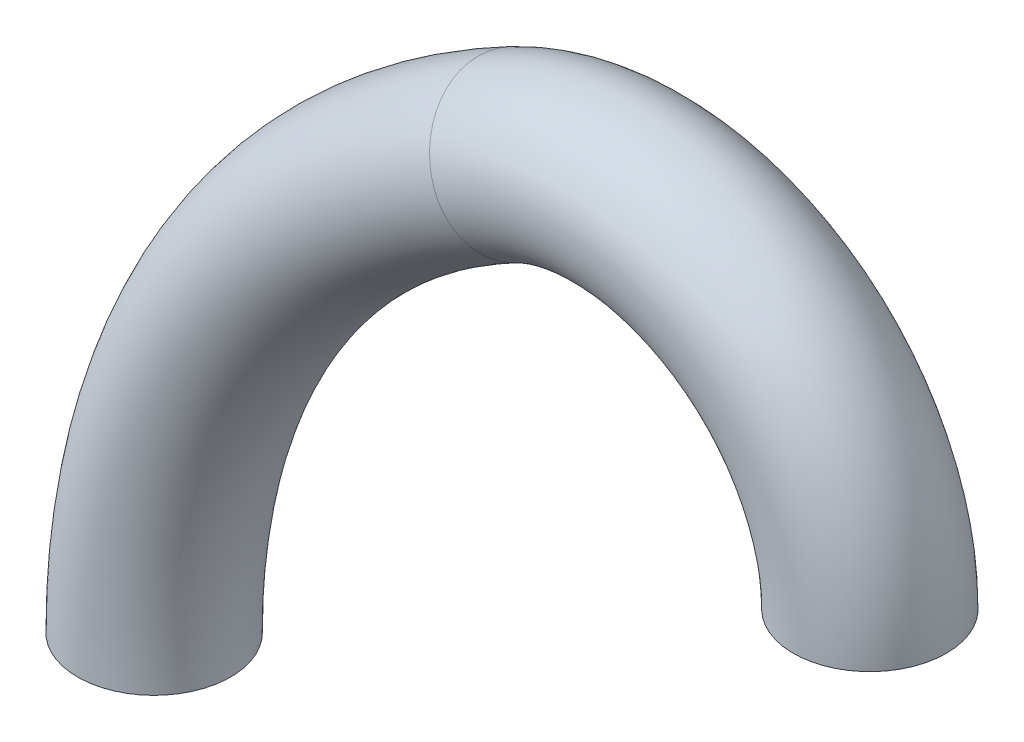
SolidWorks part; units mm, degrees
ref_plane "Front Plane" through (0, 0, 0) normal (0, 0, 1) x (1, 0, 0)
ref_plane "Top Plane" through (0, 0, 0) normal (0, 1, 0) x (1, 0, 0)
ref_plane "Right Plane" through (0, 0, 0) normal (1, 0, 0) x (0, 0, -1)
sketch "Sketch1" plane through (0, 0, 0) normal (0, 0, 1) x (1, 0, 0)
  line L0 (0, 0) -> (0, 26.3873) construction
  arc A1 (0, 0) -> (18.6531, 30.8011) centre (34.7568, 0) cw
  arc A2 (18.6531, 30.8011) -> (37.1135, 19.6215) centre (24.4981, 19.6215) cw
  point P0 (37.1135, 19.6215)
  dimension "D1" = 19.6215
  dimension "D2" = 41.9811
sketch "Sketch2" plane through (0, 0, 0) normal (0, 1, 0) x (1, 0, 0)
  circle A0 centre (0, 0) radius 3.9688
  dimension "D1" = 7.9375
sweep "Sweep1" add profiles "Sketch2" path "Sketch1"
